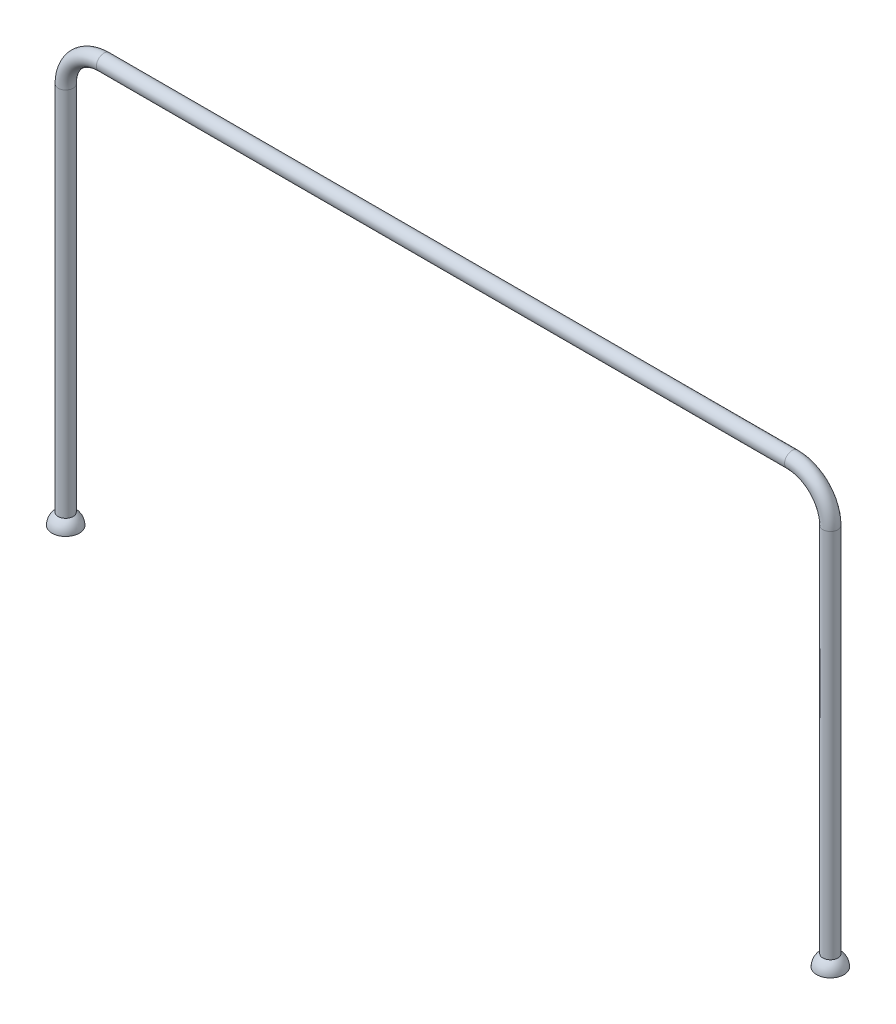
SolidWorks part; units mm, degrees
ref_plane "Front Plane" through (0, 0, 0) normal (0, 0, 1) x (1, 0, 0)
ref_plane "Top Plane" through (0, 0, 0) normal (0, 1, 0) x (1, 0, 0)
ref_plane "Right Plane" through (0, 0, 0) normal (1, 0, 0) x (0, 0, -1)
sketch "Sketch1" plane through (0, 0, 0) normal (0, 0, 1) x (1, 0, 0)
  line L0 (70, 0) -> (70, 70)
  line L1 (63, 77) -> (-63, 77)
  line L2 (-70, 70) -> (-70, 0)
  arc A0 (70, 70) -> (63, 77) centre (63, 70) ccw
  arc A1 (-63, 77) -> (-70, 70) centre (-63, 70) ccw
  point P9 (0, 77)
  dimension "D1" = 7
  dimension "D2" = 140
  dimension "D3" = 70
sketch "Sketch2" plane through (0, 0, 0) normal (0, 1, 0) x (1, 0, 0)
  line L0 (63, 0) -> (70, 0) construction
  circle A0 centre (70, 0) radius 1.375
  dimension "D1" = 2.75
sweep "Sweep1" add profiles "Sketch2" path "Sketch1"
sketch "Sketch3" plane through (0, 0, 0) normal (0, 0, 1) x (1, 0, 0)
  line L0 (-72.5, 0) -> (-70, 0)
  line L2 (-70, -3.4146) -> (-70, 4.0098) construction
  line L3 (-71.375, 0) -> (-68.625, 0) construction
  line L5 (-70, 0) -> (-70, 2.5)
  arc A0 (-72.5, 0) -> (-70, 2.5) centre (-70, 0) cw
  dimension "D2" = 2.5
revolve "Revolve1" add sketch "Sketch3" angle 360 about L2
mirror "Mirror1" about plane through (0, 0, 0) normal (1, 0, 0) of "Revolve1"
sketch "Sketch4" plane through (0, 0, 0) normal (0, 0, 1) x (1, 0, 0)
  line L4 (-63, 77) -> (-45, 77) construction
  line L7 (-63, 78.375) -> (-63, 75.625) construction
  line L8 (-45, 77) -> (-27, 77) construction
  line L9 (-27, 77) -> (-9, 77) construction
  line L10 (-9, 77) -> (9, 77) construction
  line L11 (9, 77) -> (27, 77) construction
  line L12 (27, 77) -> (45, 77) construction
  line L13 (45, 77) -> (63, 77) construction
  line L14 (63, 78.375) -> (63, 75.625) construction
  circle A33 centre (-54, 77) radius 0.9
  circle A34 centre (-36, 77) radius 0.9
  circle A35 centre (-18, 77) radius 0.9
  circle A36 centre (0, 77) radius 0.9
  circle A37 centre (18, 77) radius 0.9
  circle A38 centre (36, 77) radius 0.9
  circle A39 centre (54, 77) radius 0.9
  dimension "D1" = 1.8
sketch "Sketch5" plane through (0, 0, 0) normal (0, 0, 1) x (1, 0, 0)
  line L0 (61.6661, 77) -> (-63, 77) construction
  line L1 (-63, 78.375) -> (-63, 75.625) construction
extrude "Cut-Extrude1" cut sketch "Sketch4" against normal up to next
